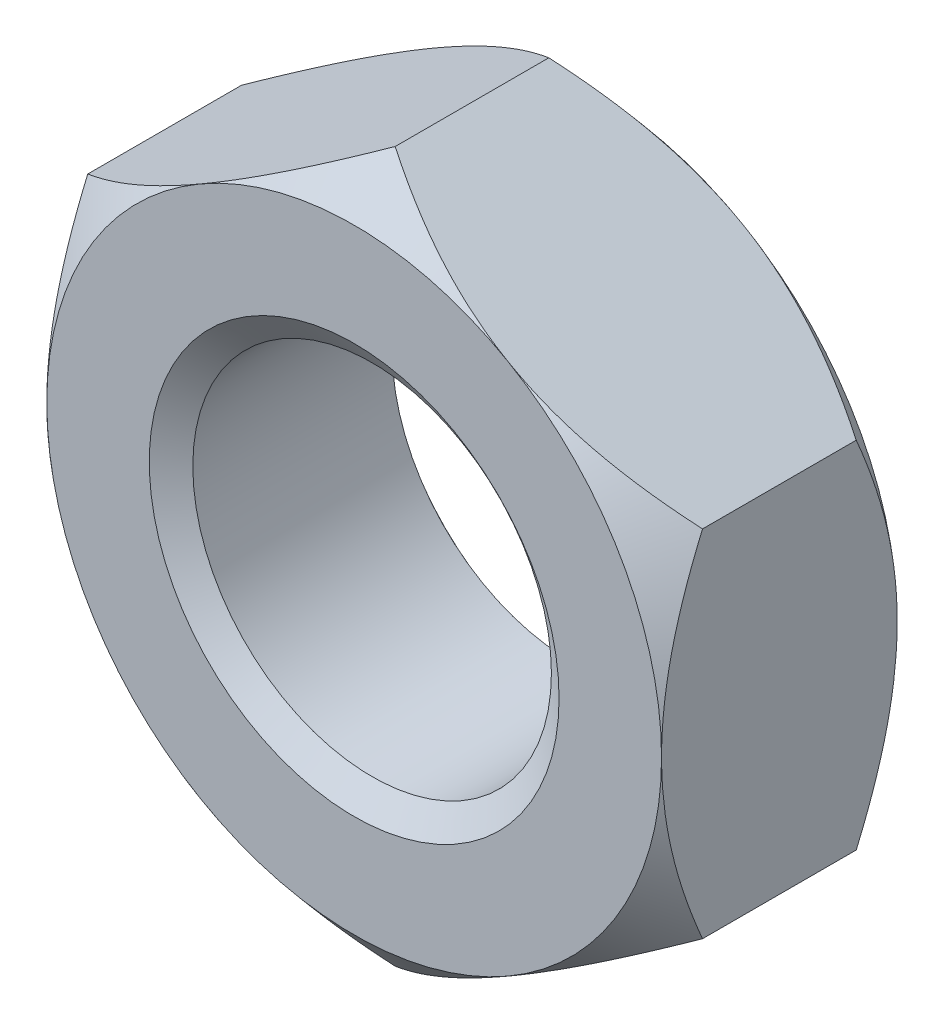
SolidWorks part; units mm, degrees
extrude "BaseNut" add sketch "BaseNutSke" against normal blind 14.605
sketch "BaseNutSke" plane through (0, 0, 0) normal (0, 0, 1) x (1, 0, 0)
  line L6 (19.05, 10.9985) -> (19.05, -10.9985)
  line L7 (-19.05, 10.9985) -> (-19.05, -10.9985)
  line L8 (19.05, 10.9985) -> (0, 21.997)
  line L9 (0, 21.997) -> (-19.05, 10.9985)
  line L10 (-19.05, -10.9985) -> (0, -21.997)
  line L11 (0, -21.997) -> (19.05, -10.9985)
  circle A0 centre (0, 0) radius 11.1125
ref_plane "Plane1" through (0, 0, 0) normal (0, 0, 1) x (1, 0, 0)
ref_plane "Plane2" through (0, 0, 0) normal (0, 1, 0) x (1, 0, 0)
ref_plane "Plane3" through (0, 0, 0) normal (1, 0, 0) x (0, 0, -1)
other "Configuration Table"
sketch "Sketch4" plane through (0, 0, 0) normal (1, 0, 0) x (0, 0, -1)
  line L0 (14.605, 19.05) -> (14.1986, 19.05)
  line L1 (14.605, 19.05) -> (14.605, 34.697)
  line L2 (14.1986, 34.697) -> (14.605, 34.697)
  line L3 (14.1986, 34.697) -> (14.1986, 19.05)
  line L4 (0, 0) -> (34.925, 0) construction
  line L6 (14.605, 10.9985) -> (14.605, 21.997) construction
  line L7 (0, 19.05) -> (-12.7, 19.05)
  line L8 (0, 10.9985) -> (0, 21.997) construction
  line L9 (2.54, 21.997) -> (2.54, 34.697)
  line L10 (2.54, 34.697) -> (-12.7, 34.697)
  line L11 (-12.7, 34.697) -> (-12.7, 19.05)
  line L12 (0, 19.05) -> (2.54, 21.997)
  line L14 (0, 10.9985) -> (0, -10.9985) construction
  line L15 (14.605, 21.997) -> (0, 21.997) construction
revolve "Bearing-Face" [suppressed] cut sketch "Sketch4" angle 360 about L4
sketch "Sketch3" plane through (0, 0, 0) normal (1, 0, 0) x (0, 0, -1)
  line L0 (14.605, 19.05) -> (12.065, 21.997)
  line L1 (12.065, 21.997) -> (12.065, 34.697)
  line L2 (12.065, 34.697) -> (27.305, 34.697)
  line L3 (27.305, 34.697) -> (27.305, 19.05)
  line L4 (27.305, 19.05) -> (14.605, 19.05)
  line L5 (14.605, 10.9985) -> (14.605, 21.997) construction
  line L6 (14.605, 21.997) -> (0, 21.997) construction
  line L7 (0, 0) -> (38.6776, 0) construction
  line L8 (14.605, 0) -> (0, 0) construction
  line L9 (7.3025, 21.997) -> (7.3025, 44.222) construction
  line L10 (2.54, 34.697) -> (-12.7, 34.697)
  line L11 (-12.7, 34.697) -> (-12.7, 19.05)
  line L12 (-12.7, 19.05) -> (0, 19.05)
  line L13 (0, 19.05) -> (2.54, 21.997)
  line L14 (2.54, 21.997) -> (2.54, 34.697)
  line L16 (14.605, 21.997) -> (0, 21.997) construction
revolve "Double-Chamfer" cut sketch "Sketch3" angle 360 about L7
sketch "EndChamferSke" plane through (0, 0, 0) normal (1, 0, 0) x (0, 0, -1)
  line L0 (14.5796, 12.7) -> (13.3569, 10.9538)
  line L1 (14.6304, 12.7) -> (14.5796, 12.7)
  line L2 (14.6304, 12.7) -> (14.6304, 10.9538)
  line L3 (14.6304, 10.9538) -> (13.3569, 10.9538)
  line L6 (-0.0508, 12.7) -> (0, 12.7)
  line L7 (0, 12.7) -> (1.2227, 10.9538)
  line L9 (1.2227, 10.9538) -> (-0.0508, 10.9538)
  line L10 (-0.0508, 10.9538) -> (-0.0508, 12.7)
  line L11 (25.0375, 0) -> (38.388, 0) construction
sketch "ThdSchSke" plane through (0, 0, 0) normal (0, 1, 0) x (1, 0, 0)
  line L0 (-12.7, 0.0254) -> (-11.1125, 1.137)
  line L1 (-11.1125, 1.137) -> (-5.5562, 1.137)
  line L2 (-5.5562, 1.137) -> (-5.5562, -1.0862)
  line L3 (-5.5562, -1.0862) -> (-11.1125, -1.0862)
  line L4 (-11.1125, -1.0862) -> (-12.7, 0.0254)
  line L6 (0, 1.6129) -> (0, -2.9874) construction
  line L7 (-6.35, 1.6129) -> (6.35, 1.6129) construction
revolve "EndChamfer" cut sketch "EndChamferSke" angle 360 about L11
revolve "ThreadSchematic" [suppressed] cut sketch "ThdSchSke" angle 360 about L6
pattern_linear "ThdSchPat" [suppressed]
equation "\"D2@BaseNutSke\" = \"Width_flats@BaseNutSke\" / 2"
equation "\"D3@BaseNutSke\" = \"Width_flats@BaseNutSke\" / 2"
equation "\"D1@Sketch3\" = \"Width_flats@BaseNutSke\" /2"
equation "\"D2@Sketch3\" = \"Thread_major@ThreadCosmetic\" *.1"
equation "\"D1@Sketch4\" = \"D2@BaseNutSke\""
equation "\"D2@Sketch4\" = \"Thread_major@ThreadCosmetic\" *.10"
equation "\"D4@BaseNutSke\" = \"D3@BaseNutSke\""
equation "\"Thread_major@ThdSchSke\" = \"Thread_major@ThreadCosmetic\""
equation "\"Tap_drill@ThdSchSke\" = \"Thread_min@BaseNutSke\""
equation "\"OverCut@ThdSchSke\" = \"Tap_drill@ThdSchSke\" * 0.5"
equation "\"Num_threads@ThdSchPat\" = int(  ( \"Thickness@BaseNut\" - 0.002 ) / \"Advance@ThdSchSke\" + 0.999 )  + 1"
equation "\"Advance@ThdSchPat\" = ( \"Thickness@BaseNut\" - 0.002 ) /  (\"Num_threads@ThdSchPat\" - 1) 'relax it"
equation "' \"Num_threads@ThdSchPat\" = \"Num_threads@ThdSchPat\" - sgn( \"Num_threads@ThdSchPat\" - 1) '---chamfered tips only---"
equation "\"ThreadMajor@EndChamferSke\" = \"Thread_major@ThreadCosmetic\" * 0.5"
equation "\"ChamferDepth@EndChamferSke\" = (\"Thread_major@ThreadCosmetic\" - \"Thread_min@BaseNutSke\") * 0.55"
equation "\"Offset1@EndChamferSke\" = \"Thickness@BaseNut\" + 0.001"
equation "\"Offset2@EndChamferSke\" = \"Offset1@EndChamferSke\" + 0.002"
